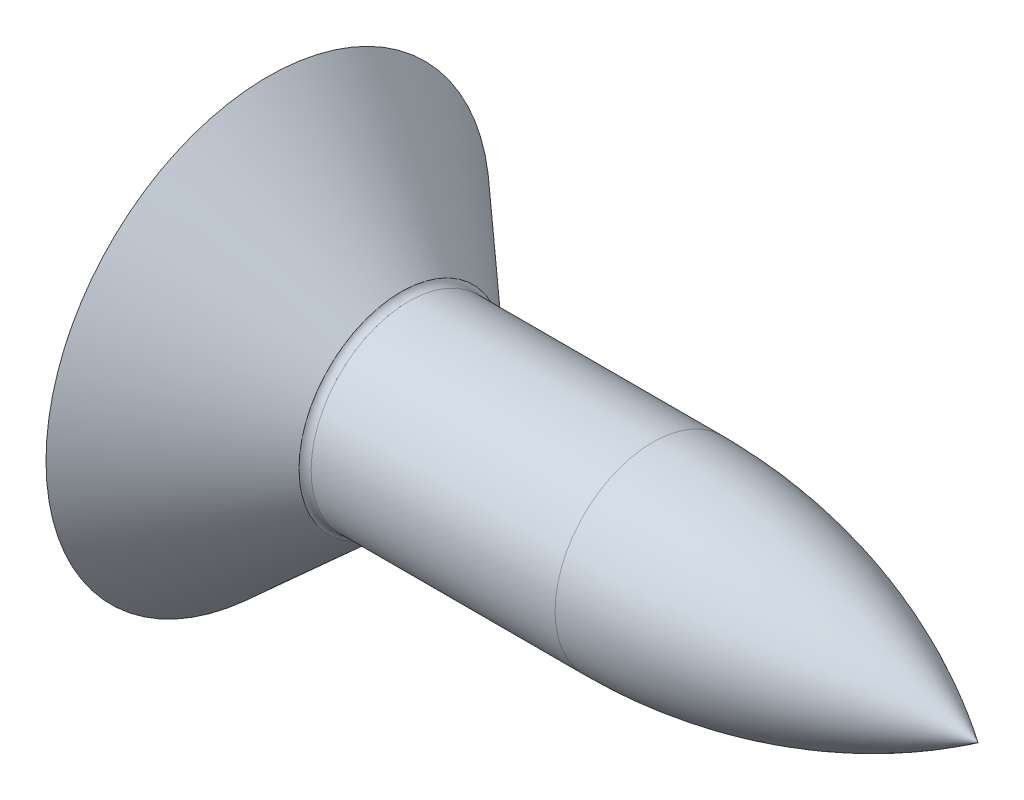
SolidWorks part; units mm, degrees
ref_plane "Plane1" through (0, 0, 0) normal (0, 0, 1) x (1, 0, 0)
ref_plane "Plane2" through (0, 0, 0) normal (0, 1, 0) x (1, 0, 0)
ref_plane "Plane3" through (0, 0, 0) normal (1, 0, 0) x (0, 0, -1)
sketch "BodySke" plane through (0, 0, 0) normal (0, 0, 1) x (1, 0, 0)
  line L0 (1.5, 1.1) -> (1.5, 1.15)
  line L1 (1.725, 6.35) -> (1.725, -3.175) construction
  line L2 (-25.4, 0) -> (127, 0) construction
  line L3 (8, 0) -> (0, 0)
  line L4 (1.5, 1.1) -> (4.3354, 1.1)
  line L5 (0, 0) -> (0, 2.5)
  line L6 (0, 2.5) -> (1.5, 1.15)
  line L8 (2.1, 6.35) -> (2.1, -3.175) construction
  arc A1 (8, 0) -> (4.3354, 1.1) centre (4.3354, -5.5544) ccw
  point P19 (1.5, 2.5)
  dimension "D3" = 0.05
  dimension "D1" = 1.1
  dimension "D2" = 6.5
  dimension "Head_ht" = 1.5
  dimension "Advance" = 0.45
revolve "Base-Revolve" add sketch "BodySke"
fillet "Fillet1" radius 0.1 1 edges at (1.5, 0, 1.1)
sketch "Sketch3" plane through (0, 0, 0) normal (1, 0, 0) x (0, 0, -1)
  line L0 (0.37, -1.3) -> (-0.37, -1.3)
  line L1 (0.37, -1.3) -> (0.37, 1.3)
  line L2 (-0.37, 1.3) -> (0.37, 1.3)
  line L3 (-0.37, 1.3) -> (-0.37, -1.3)
  dimension "D1" = 1.3
  dimension "Cross_dia" = 2.6
  dimension "D2" = 0.37
  dimension "Cross_width" = 0.74
ref_plane "Plane4" through (1.5, 0, 0) normal (1, 0, 0) x (0, 0, -1)
sketch "Sketch4" plane through (1.5, 0, 0) normal (1, 0, 0) x (0, 0, -1)
  line L0 (0.37, -0.5521) -> (-0.37, -0.5521)
  line L1 (0.37, -0.5521) -> (0.37, 0.5521)
  line L2 (-0.37, 0.5521) -> (0.37, 0.5521)
  line L3 (-0.37, 0.5521) -> (-0.37, -0.5521)
  dimension "D1" = 0.74
  dimension "D2" = 1.1043
  dimension "D3" = 0.37
  dimension "D4" = 0.5521
loft "Recess" cut profiles "Sketch3", "Sketch4"
pattern_circular "RecPat" count 2 every 90 about axis through (0, 0, 0) along (1, 0, 0) of "Recess"
sketch "RecCorSke" plane through (0, 0, 0) normal (0, 0, 1) x (1, 0, 0)
  line L0 (-3.175, 0) -> (15.875, 0) construction
  line L1 (-25.4, 0) -> (127, 0) construction
  line L2 (0, 0) -> (0, 0.6609)
  line L3 (0, 0.6609) -> (1.5, 0.556)
  line L4 (1.5, 0.556) -> (1.6807, 0)
  line L5 (1.6807, 0) -> (0, 0)
  dimension "Diameter" = 1.112
  dimension "Depth" = 1.5
  dimension "Draft_angle" = 4
  dimension "Bottom_angle" = 18
revolve "RecessCore" cut sketch "RecCorSke" angle 360 about L0
sketch "ThdSchSke" plane through (0, 0, 0) normal (0, 0, 1) x (1, 0, 0)
  line L0 (3, -0.9965) -> (2.8225, -1.25)
  line L1 (3, -0.9965) -> (3.1775, -1.25)
  line L2 (3.1775, -1.25) -> (3.1775, -1.5625)
  line L3 (-3.175, 0) -> (5.1513, 0) construction
  line L5 (3.1775, -1.5625) -> (2.8225, -1.5625)
  line L6 (2.8225, -1.5625) -> (2.8225, -1.25)
  dimension "Thread_minor" = 1.993
  dimension "Diameter" = 2.5
  dimension "Start" = 3
  dimension "SideAngle" = 55
  dimension "VeeAngle" = 70
  dimension "Overcut" = 3.125
revolve "ThreadSchematic" cut sketch "ThdSchSke" angle 360 about L3
pattern_linear "ThdSchPat"
